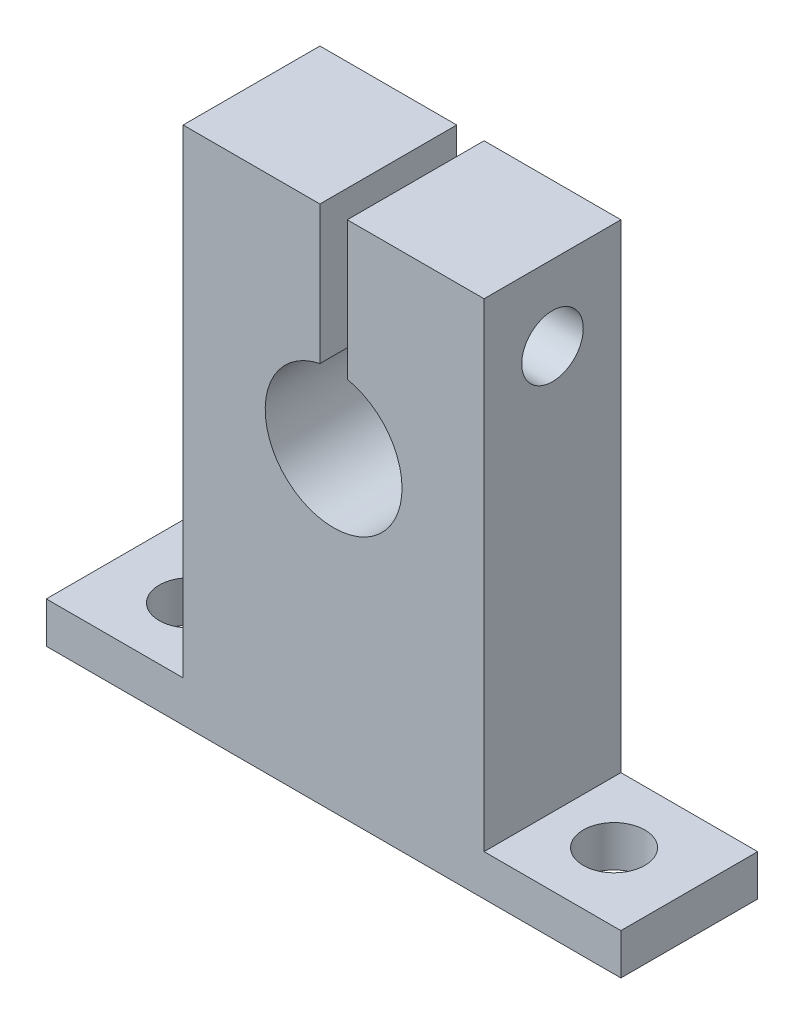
SolidWorks part; units mm, degrees
ref_plane "Front Plane" through (0, 0, 0) normal (0, 0, 1) x (1, 0, 0)
ref_plane "Top Plane" through (0, 0, 0) normal (0, 1, 0) x (1, 0, 0)
ref_plane "Right Plane" through (0, 0, 0) normal (1, 0, 0) x (0, 0, -1)
sketch "Sketch2" plane through (0, 0, 0) normal (0, 0, 1) x (1, 0, 0)
  line L3 (-11, 3) -> (-11, 15)
  line L4 (-11, 15) -> (11, 15)
  line L5 (11, 15) -> (11, 3)
  line L6 (-11, 3) -> (-11, -20)
  line L7 (-11, -20) -> (-21, -20)
  line L8 (-21, -20) -> (-21, -23)
  line L9 (11, 3) -> (11, -20)
  line L10 (11, -20) -> (21, -20)
  line L11 (21, -20) -> (21, -23)
  line L12 (21, -23) -> (-21, -23)
  circle A0 centre (0, 0) radius 5
  dimension "D1" = 10
  dimension "D2" = 23
  dimension "D3" = 12
  dimension "D4" = 3
  dimension "D5" = 12
  dimension "D6" = 23
  dimension "D7" = 3
  dimension "D8" = 22
extrude "Boss-Extrude1" add sketch "Sketch2" along normal blind 10
sketch "Sketch4" plane through (0, -20, 0) normal (0, 1, 0) x (1, 0, 0)
  circle A0 centre (-15.5, -5) radius 2.25
  circle A1 centre (15.5, -5) radius 2.25
extrude "Cut-Extrude2" cut sketch "Sketch4" against normal blind 10
sketch "Sketch5" plane through (11, 0, 0) normal (1, 0, 0) x (0, 0, -1)
  circle A0 centre (-5, 9.5) radius 2.25
extrude "Cut-Extrude3" cut sketch "Sketch5" against normal blind 30
sketch "Sketch6" plane through (0, 15, 0) normal (0, 1, 0) x (1, 0, 0)
  line L0 (0, 0) -> (1, 0)
  line L1 (11, 0) -> (-11, 0) construction
  line L2 (1, 0) -> (1, -10)
  line L3 (11, -10) -> (-11, -10) construction
  line L4 (1, -10) -> (-1, -10)
  line L5 (-1, -10) -> (-1, 0)
  line L6 (-1, 0) -> (0, 0)
extrude "Cut-Extrude4" cut sketch "Sketch6" against normal blind 15
